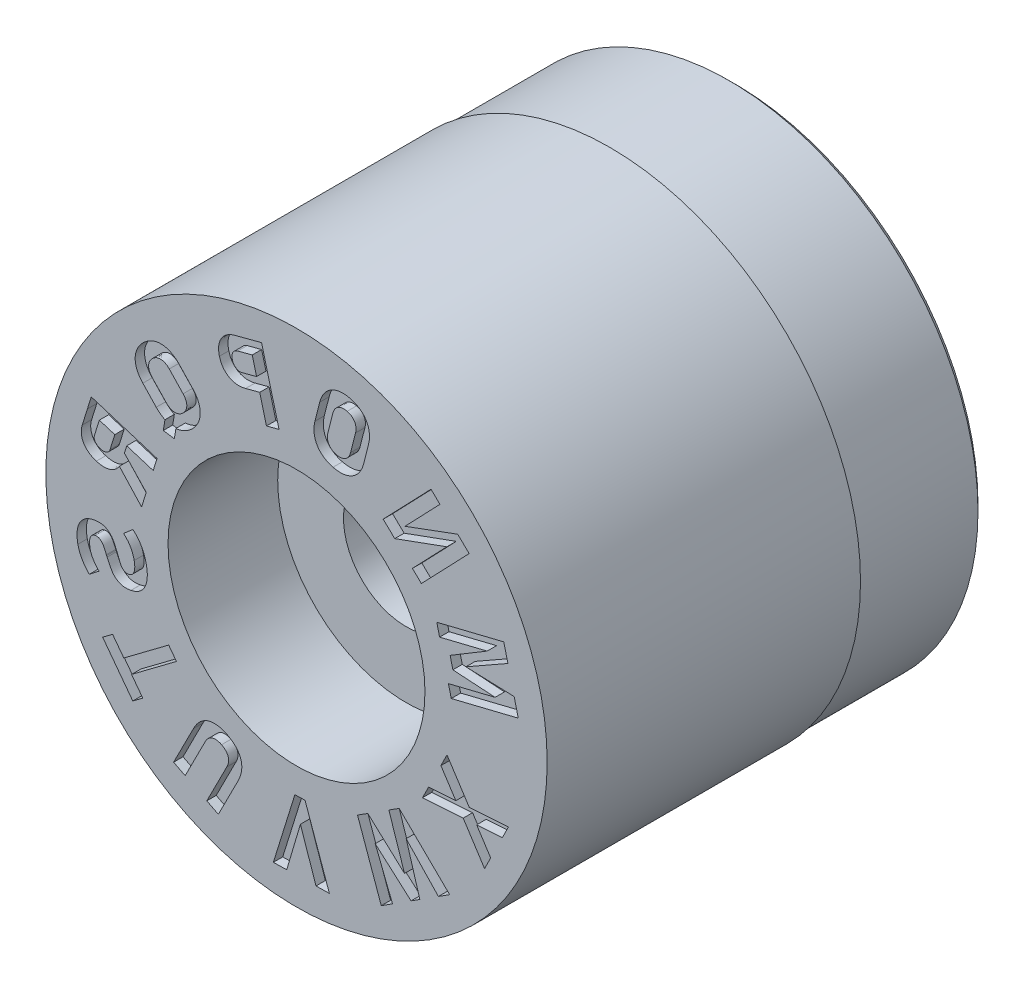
SolidWorks part; units mm, degrees
ref_plane "Front Plane" through (0, 0, 0) normal (0, 0, 1) x (1, 0, 0)
ref_plane "Top Plane" through (0, 0, 0) normal (0, 1, 0) x (1, 0, 0)
ref_plane "Right Plane" through (0, 0, 0) normal (1, 0, 0) x (0, 0, -1)
sketch "Sketch1" plane through (0, 0, 0) normal (1, 0, 0) x (0, 0, -1)
  line L2 (0, 8) -> (0, 4.1)
  line L3 (13.75, 8) -> (0, 8)
  line L4 (-3.7979, 0) -> (49996.2021, 0) construction
  line L8 (14, 2) -> (3.5, 2)
  line L9 (3.5, 4.1) -> (3.5, 2)
  line L10 (3.5, 4.1) -> (0, 4.1)
  line L12 (14, 2) -> (14, 7.75)
  line L16 (14, 7.75) -> (13.75, 8)
  dimension "D1" = 14
  dimension "D2" = 45
  dimension "D3" = 0.25
  dimension "D4" = 16
  dimension "D5" = 8.2
  dimension "D6" = 3.5
  dimension "D7" = 4
revolve "Revolve1" add sketch "Sketch1" angle 360 about L4
sketch "Sketch4" plane through (0, 0, 0) normal (1, 0, 0) x (0, 0, -1)
  line L0 (0, 0) -> (50000, 0) construction
  line L1 (14, -7.75) -> (14, 7.75) construction
  line L2 (10, 8.935) -> (14, 8.935)
  line L3 (10, 8.935) -> (10, 7.935)
  line L4 (10, 7.935) -> (14, 7.935)
  line L5 (14, 8.935) -> (14, 7.935)
  line L6 (13.75, 8) -> (0, 8) construction
  line L9 (0, 8.8) -> (0, -8.8) construction
  dimension "D1" = 1
  dimension "D2" = 0.065
  dimension "D3" = 10
revolve "Cut-Revolve1" cut sketch "Sketch4" angle 360 about L0
sketch "Sketch6" plane through (0, 0, 0) normal (0, 0, 1) x (1, 0, 0)
  line L0 (6.7464, 2.1075) -> (6.6157, 2.6387)
  line L1 (6.6157, 2.6387) -> (4.477, 2.1123)
  line L2 (4.477, 2.1123) -> (4.567, 1.746)
  line L3 (4.567, 1.746) -> (6.0852, 2.1194)
  line L5 (6.0852, 2.1194) -> (4.9026, 1.4101)
  line L6 (4.9026, 1.4101) -> (4.9902, 1.0541)
  line L7 (4.9902, 1.0541) -> (6.3387, 0.9681)
  line L9 (6.3387, 0.9681) -> (4.8489, 0.6017)
  line L10 (4.8489, 0.6017) -> (4.9388, 0.2354)
  line L11 (4.9388, 0.2354) -> (7.0775, 0.7617)
  line L12 (7.0775, 0.7617) -> (6.9468, 1.293)
  line L13 (6.9468, 1.293) -> (5.4052, 1.3451)
  line L14 (5.4052, 1.3451) -> (6.7464, 2.1075)
  line L15 (5.5114, 4.5272) -> (5.1446, 4.8792)
  line L16 (5.1446, 4.8792) -> (3.461, 4.2568)
  line L18 (3.461, 4.2568) -> (4.5786, 5.4219)
  line L19 (4.5786, 5.4219) -> (4.2921, 5.6967)
  line L20 (4.2921, 5.6967) -> (2.7665, 4.1064)
  line L21 (2.7665, 4.1064) -> (3.1351, 3.7528)
  line L22 (3.1351, 3.7528) -> (4.7985, 4.3588)
  line L24 (4.7985, 4.3588) -> (3.6988, 3.2123)
  line L25 (3.6988, 3.2123) -> (3.9858, 2.937)
  line L26 (3.9858, 2.937) -> (5.5114, 4.5272)
  line L27 (2.1433, 5.3276) -> (2.2971, 5.9308)
  line L28 (0.7419, 6.3278) -> (0.5881, 5.7246)
  line L29 (1.0015, 5.6085) -> (1.1608, 6.232)
  line L30 (1.8843, 6.0472) -> (1.725, 5.4236)
  line L31 (-1.275, 6.0266) -> (-1.7356, 5.9053)
  line L32 (-1.8744, 6.4332) -> (-1.4138, 6.5545)
  line L33 (-1.515, 6.9393) -> (-1.2975, 6.9966)
  line L34 (-1.515, 6.9393) -> (-1.9652, 6.8208)
  line L35 (-1.6242, 5.5232) -> (-1.1739, 5.6418)
  line L36 (-1.1739, 5.6418) -> (-0.9577, 4.8198)
  line L37 (-1.1153, 7.0442) -> (-1.515, 6.9393)
  line L38 (-1.4138, 6.5545) -> (-1.275, 6.0266)
  line L39 (-0.9577, 4.8198) -> (-0.558, 4.9246)
  line L40 (-0.558, 4.9246) -> (-1.1153, 7.0442)
  line L41 (-5.4183, 2.0419) -> (-4.5739, 1.7796)
  line L42 (-4.1977, 3.373) -> (-4.2512, 3.048)
  line L43 (-4.2512, 3.048) -> (-3.8988, 2.9963)
  line L44 (-3.8988, 2.9963) -> (-3.8481, 3.306)
  line L45 (-3.3167, 4.6804) -> (-3.7439, 5.1306)
  line L46 (-4.9047, 4.0291) -> (-4.4775, 3.5789)
  line L47 (-4.1594, 3.8661) -> (-4.6011, 4.3315)
  line L48 (-4.0611, 4.8437) -> (-3.6194, 4.3784)
  line L49 (-5.7995, 2.1603) -> (-5.9526, 1.6677)
  line L50 (-6.4464, 1.821) -> (-6.2933, 2.3136)
  line L51 (-6.2933, 2.3136) -> (-5.7995, 2.1603)
  line L52 (-6.6739, 2.4318) -> (-6.8367, 1.908)
  line L53 (-5.4929, 1.8018) -> (-5.4183, 2.0419)
  line L54 (-5.5113, -3.87) -> (-5.8687, -3.3935)
  line L55 (-6.5513, 2.8275) -> (-6.6741, 2.4319)
  line L56 (-6.6741, 2.4319) -> (-6.6739, 2.4318)
  line L57 (-4.5739, 1.7796) -> (-4.4511, 2.1752)
  line L58 (-4.4511, 2.1752) -> (-6.5513, 2.8275)
  line L60 (-5.6536, 1.3577) -> (-4.944, 0.587)
  line L61 (-4.944, 0.587) -> (-4.7951, 1.0664)
  line L62 (-4.7951, 1.0664) -> (-5.4929, 1.8018)
  line L63 (-5.221, -0.1738) -> (-5.5184, -0.4295)
  line L64 (-5.3549, -1.4803) -> (-5.3564, -1.4804)
  line L65 (-5.6922, -1.1371) -> (-5.7034, -1.1054)
  line L66 (-6.4725, -0.5301) -> (-6.4743, -0.5303)
  line L67 (-6.6134, -2.1068) -> (-6.303, -1.8662)
  line L68 (-6.432, -0.9418) -> (-6.4306, -0.9417)
  line L69 (-5.2849, -1.8861) -> (-5.2817, -1.8857)
  line L71 (-5.2639, -4.1997) -> (-3.8318, -3.1256)
  line L72 (-3.8318, -3.1256) -> (-4.079, -2.7957)
  line L73 (-4.079, -2.7957) -> (-5.5113, -3.87)
  line L74 (-6.1871, -3.6319) -> (-5.2249, -4.9146)
  line L75 (-5.2249, -4.9146) -> (-4.9065, -4.6762)
  line L76 (-4.9065, -4.6762) -> (-5.2639, -4.1997)
  line L77 (-5.8687, -3.3935) -> (-6.1871, -3.6319)
  line L78 (-3.2882, -4.7082) -> (-3.9221, -5.9559)
  line L79 (-3.9221, -5.9559) -> (-3.5536, -6.143)
  line L80 (-3.5536, -6.143) -> (-2.9151, -4.8858)
  line L81 (-2.224, -5.2369) -> (-2.8626, -6.4942)
  line L82 (-2.8626, -6.4942) -> (-2.4941, -6.6813)
  line L83 (-2.4941, -6.6813) -> (-1.8602, -5.4336)
  line L84 (-0.7394, -7.1323) -> (-0.3126, -7.1238)
  line L85 (-0.3126, -7.1238) -> (0.125, -5.6466)
  line L86 (0.125, -5.6466) -> (0.6222, -7.1048)
  line L87 (0.6222, -7.1048) -> (1.0491, -7.0963)
  line L88 (1.0491, -7.0963) -> (0.2726, -4.911)
  line L89 (0.2726, -4.911) -> (-0.0515, -4.9175)
  line L90 (-0.0515, -4.9175) -> (-0.7394, -7.1323)
  line L91 (3.6563, -5.9987) -> (3.9362, -5.8196)
  line L92 (3.9362, -5.8196) -> (3.5003, -4.3574)
  line L93 (3.5003, -4.3574) -> (4.5287, -5.4408)
  line L94 (4.5287, -5.4408) -> (4.8879, -5.2111)
  line L95 (4.8879, -5.2111) -> (3.2769, -3.6323)
  line L96 (3.2769, -3.6323) -> (2.948, -3.8425)
  line L97 (2.948, -3.8425) -> (3.4472, -5.346)
  line L98 (3.4472, -5.346) -> (2.2759, -4.2724)
  line L99 (2.2759, -4.2724) -> (1.9474, -4.4827)
  line L100 (1.9474, -4.4827) -> (2.705, -6.6074)
  line L101 (2.705, -6.6074) -> (3.0642, -6.3777)
  line L102 (3.0642, -6.3777) -> (2.5119, -4.9895)
  line L103 (2.5119, -4.9895) -> (3.6563, -5.9987)
  line L105 (5.3198, -2.8798) -> (6.0024, -3.9343)
  line L106 (6.0024, -3.9343) -> (6.1975, -3.5416)
  line L107 (6.1975, -3.5416) -> (5.7497, -2.8505)
  line L109 (5.5137, -2.4868) -> (4.8039, -1.39)
  line L110 (4.8039, -1.39) -> (4.6088, -1.7828)
  line L111 (4.6088, -1.7828) -> (5.0843, -2.5162)
  line L112 (5.7497, -2.8505) -> (6.5693, -2.7943)
  line L113 (6.5693, -2.7943) -> (6.7644, -2.4016)
  line L114 (6.7644, -2.4016) -> (5.5137, -2.4868)
  line L115 (5.0843, -2.5162) -> (4.2143, -2.5759)
  line L116 (4.2143, -2.5759) -> (4.0192, -2.9686)
  line L117 (4.0192, -2.9686) -> (5.3198, -2.8798)
  spline S0 degree 3 poles (1.1653, 4.7409) (1.203, 4.732) (1.2592, 4.7195) (1.3344, 4.7119) (1.389, 4.7091) (1.4427, 4.71) (1.4955, 4.7141) (1.5474, 4.7221) (1.5982, 4.7332) (1.6476, 4.7481) (1.6952, 4.7659) (1.7411, 4.787) (1.785, 4.8112) (1.827, 4.8389) (1.8672, 4.8693) (1.9056, 4.903) (1.9421, 4.9398) (1.9764, 4.9793) (2.0081, 5.0215) (2.0372, 5.0663) (2.0634, 5.1138) (2.0873, 5.1636) (2.117, 5.234) (2.1332, 5.2898) (2.1433, 5.3276) knots 0 0 0 0 0.090554 0.13409 0.176391 0.218073 0.259307 0.299989 0.340594 0.380562 0.420342 0.459142 0.498428 0.53716 0.576489 0.616141 0.656309 0.697182 0.738191 0.779538 0.821765 0.8647 0.908479 1 1 1 1
  spline S1 degree 3 poles (2.2971, 5.9308) (2.307, 5.9687) (2.3177, 6.0257) (2.3273, 6.1017) (2.3296, 6.157) (2.3292, 6.2112) (2.3251, 6.2643) (2.318, 6.3167) (2.3067, 6.3678) (2.2927, 6.4177) (2.2747, 6.4655) (2.2547, 6.5119) (2.2302, 6.5556) (2.204, 6.5983) (2.1734, 6.6383) (2.1403, 6.677) (2.1038, 6.7133) (2.0646, 6.7474) (2.0231, 6.7794) (1.9788, 6.8086) (1.932, 6.8351) (1.8826, 6.8587) (1.8128, 6.8879) (1.7578, 6.9047) (1.7203, 6.9143) knots 0 0 0 0 0.091341 0.135407 0.178493 0.220488 0.262023 0.302787 0.343665 0.384141 0.423666 0.462901 0.501902 0.540681 0.5797 0.619483 0.659323 0.699862 0.740591 0.781629 0.823523 0.866115 0.909552 1 1 1 1
  spline S2 degree 3 poles (1.7203, 6.9143) (1.683, 6.9245) (1.6266, 6.935) (1.5516, 6.9436) (1.4968, 6.9467) (1.4431, 6.9452) (1.3904, 6.9409) (1.3385, 6.933) (1.2877, 6.9217) (1.2382, 6.9074) (1.1906, 6.8894) (1.1448, 6.8684) (1.1007, 6.8445) (1.0588, 6.8167) (1.0186, 6.7863) (0.98, 6.7526) (0.9437, 6.7156) (0.9092, 6.676) (0.8776, 6.6337) (0.8479, 6.5893) (0.8219, 6.5416) (0.7979, 6.4919) (0.7682, 6.4215) (0.752, 6.3657) (0.7419, 6.3278) knots 0 0 0 0 0.090234 0.13364 0.176254 0.218101 0.259038 0.299716 0.340319 0.380534 0.419819 0.459105 0.498097 0.536827 0.576153 0.615801 0.6563 0.69717 0.738176 0.779554 0.821778 0.86471 0.908486 1 1 1 1
  spline S3 degree 3 poles (0.5881, 5.7246) (0.5782, 5.6868) (0.5675, 5.6297) (0.5579, 5.5538) (0.5556, 5.4985) (0.556, 5.4443) (0.56, 5.391) (0.5678, 5.3387) (0.5787, 5.2875) (0.5934, 5.2379) (0.6105, 5.1898) (0.6313, 5.1438) (0.6555, 5.0998) (0.6824, 5.0573) (0.7122, 5.0167) (0.7459, 4.9785) (0.7819, 4.9417) (0.8214, 4.9078) (0.8628, 4.8756) (0.9074, 4.847) (0.9541, 4.8205) (1.0031, 4.7963) (1.0729, 4.7675) (1.1277, 4.7503) (1.1653, 4.7409) knots 0 0 0 0 0.09134 0.135404 0.17849 0.220483 0.262018 0.302986 0.343863 0.384085 0.423845 0.462863 0.501863 0.540943 0.580112 0.619442 0.659719 0.700257 0.740985 0.781989 0.823882 0.866114 0.90955 1 1 1 1
  spline S4 degree 3 poles (1.2676, 5.1423) (1.2335, 5.1513) (1.1842, 5.1691) (1.126, 5.2049) (1.0885, 5.2363) (1.0563, 5.2718) (1.0298, 5.3114) (1.009, 5.3542) (0.9945, 5.4008) (0.9867, 5.45) (0.9836, 5.5202) (0.9928, 5.5733) (1.0015, 5.6085) knots 0 0 0 0 0.174985 0.257482 0.337889 0.41693 0.494551 0.572982 0.652657 0.735237 0.819921 1 1 1 1
  spline S5 degree 3 poles (1.1608, 6.232) (1.1706, 6.2669) (1.1872, 6.3182) (1.2239, 6.3778) (1.2544, 6.4173) (1.2893, 6.4512) (1.328, 6.4792) (1.3701, 6.501) (1.4155, 6.5169) (1.4636, 6.5261) (1.5318, 6.5303) (1.5835, 6.5216) (1.6176, 6.5131) knots 0 0 0 0 0.18045 0.264422 0.346617 0.427066 0.505014 0.58279 0.662026 0.742762 0.824933 1 1 1 1
  spline S6 degree 3 poles (1.6176, 6.5131) (1.6521, 6.5051) (1.7009, 6.4862) (1.7592, 6.4506) (1.7968, 6.4192) (1.8287, 6.3836) (1.8559, 6.3445) (1.876, 6.3011) (1.891, 6.2548) (1.8993, 6.2056) (1.9012, 6.1355) (1.8936, 6.0824) (1.8843, 6.0472) knots 0 0 0 0 0.175069 0.257563 0.337967 0.417005 0.494272 0.573144 0.653342 0.735329 0.819642 1 1 1 1
  spline S7 degree 3 poles (1.725, 5.4236) (1.7158, 5.3885) (1.6975, 5.3379) (1.6619, 5.2774) (1.6312, 5.238) (1.5964, 5.2039) (1.5572, 5.1765) (1.5151, 5.1545) (1.4698, 5.1385) (1.4217, 5.1299) (1.3536, 5.1255) (1.3018, 5.1344) (1.2676, 5.1423) knots 0 0 0 0 0.180266 0.264874 0.347008 0.427399 0.505625 0.583344 0.662522 0.742738 0.824849 1 1 1 1
  spline S8 degree 3 poles (-1.7356, 5.9053) (-1.7582, 5.8993) (-1.7925, 5.8944) (-1.8379, 5.8972) (-1.8701, 5.9042) (-1.9008, 5.9159) (-1.9299, 5.9308) (-1.9562, 5.9512) (-1.9805, 5.9749) (-2.0024, 6.0023) (-2.0267, 6.0449) (-2.0401, 6.0799) (-2.0463, 6.1045) knots 0 0 0 0 0.169219 0.248097 0.327749 0.406805 0.485095 0.564039 0.646178 0.730445 0.816959 1 1 1 1
  spline S9 degree 3 poles (-2.0463, 6.1045) (-2.0535, 6.1292) (-2.0588, 6.1668) (-2.0594, 6.2164) (-2.0539, 6.2512) (-2.0457, 6.2843) (-2.032, 6.3145) (-2.0151, 6.3427) (-1.9936, 6.3676) (-1.9687, 6.3894) (-1.9304, 6.4148) (-1.8972, 6.4269) (-1.8744, 6.4332) knots 0 0 0 0 0.184584 0.271052 0.355147 0.436297 0.515234 0.59253 0.671241 0.750119 0.829666 1 1 1 1
  spline S10 degree 3 poles (-1.9652, 6.8208) (-2.0277, 6.8039) (-2.1179, 6.7714) (-2.2245, 6.7061) (-2.2937, 6.6499) (-2.3537, 6.5867) (-2.4031, 6.5166) (-2.4414, 6.4402) (-2.4689, 6.3583) (-2.4851, 6.272) (-2.4916, 6.1495) (-2.4757, 6.0568) (-2.4603, 5.9956) knots 0 0 0 0 0.179477 0.263146 0.345424 0.425559 0.503885 0.582072 0.661518 0.742295 0.824748 1 1 1 1
  spline S11 degree 3 poles (-2.4603, 5.9956) (-2.4444, 5.9345) (-2.4115, 5.8466) (-2.3459, 5.7433) (-2.2895, 5.6762) (-2.2255, 5.6187) (-2.1545, 5.5719) (-2.0775, 5.5351) (-1.9942, 5.5099) (-1.9064, 5.4949) (-1.7814, 5.4918) (-1.6869, 5.5068) (-1.6242, 5.5232) knots 0 0 0 0 0.175519 0.257739 0.338754 0.417967 0.495682 0.57369 0.654076 0.736334 0.820263 1 1 1 1
  spline S12 degree 3 poles (-3.3408, 3.544) (-3.3126, 3.5702) (-3.2733, 3.6119) (-3.2267, 3.671) (-3.1955, 3.7159) (-3.1672, 3.7614) (-3.1434, 3.8086) (-3.1223, 3.8564) (-3.1049, 3.9053) (-3.0912, 3.9547) (-3.0809, 4.0044) (-3.074, 4.0542) (-3.0718, 4.1042) (-3.0719, 4.1542) (-3.0768, 4.2042) (-3.0844, 4.2544) (-3.0961, 4.3046) (-3.1116, 4.3543) (-3.13, 4.4037) (-3.1529, 4.4518) (-3.1786, 4.4994) (-3.2078, 4.5461) (-3.252, 4.608) (-3.2898, 4.652) (-3.3167, 4.6804) knots 0 0 0 0 0.090196 0.133908 0.176363 0.218192 0.25925 0.300021 0.340564 0.380741 0.420056 0.459394 0.498256 0.537195 0.576458 0.615803 0.656247 0.696897 0.737813 0.779475 0.821747 0.864483 0.908334 1 1 1 1
  spline S13 degree 3 poles (-3.7439, 5.1306) (-3.7702, 5.1595) (-3.8129, 5.1986) (-3.8724, 5.2462) (-3.9172, 5.2784) (-3.9636, 5.3062) (-4.0105, 5.3315) (-4.0587, 5.3527) (-4.1077, 5.3707) (-4.1572, 5.3849) (-4.2068, 5.3958) (-4.2568, 5.4021) (-4.3067, 5.406) (-4.3567, 5.4051) (-4.4067, 5.4017) (-4.4568, 5.3938) (-4.5069, 5.3826) (-4.5565, 5.3675) (-4.6056, 5.3496) (-4.6536, 5.3277) (-4.7008, 5.3022) (-4.7471, 5.2732) (-4.8085, 5.2295) (-4.8519, 5.1922) (-4.8801, 5.1659) knots 0 0 0 0 0.091445 0.135353 0.178471 0.220602 0.261946 0.303164 0.343802 0.384052 0.423761 0.462745 0.501958 0.540892 0.579709 0.619391 0.659397 0.699922 0.740693 0.781714 0.823499 0.866229 0.909583 1 1 1 1
  spline S14 degree 3 poles (-4.8801, 5.1659) (-4.9079, 5.1393) (-4.9474, 5.098) (-4.9945, 5.0392) (-5.0253, 4.9942) (-5.0532, 4.9486) (-5.0776, 4.9019) (-5.0986, 4.8539) (-5.116, 4.805) (-5.1298, 4.7555) (-5.1401, 4.7058) (-5.1467, 4.6559) (-5.15, 4.6059) (-5.1486, 4.5558) (-5.1449, 4.5057) (-5.1364, 4.4555) (-5.1248, 4.4052) (-5.1094, 4.3553) (-5.0909, 4.3059) (-5.0686, 4.2575) (-5.0428, 4.2101) (-5.0137, 4.1634) (-4.9694, 4.1014) (-4.9316, 4.0575) (-4.9047, 4.0291) knots 0 0 0 0 0.09016 0.133576 0.17632 0.217664 0.258857 0.29962 0.340153 0.380321 0.419973 0.458953 0.498157 0.537111 0.576317 0.615725 0.656161 0.69713 0.738037 0.779526 0.821788 0.864514 0.908355 1 1 1 1
  spline S15 degree 3 poles (-4.4775, 3.5789) (-4.4512, 3.55) (-4.4085, 3.5109) (-4.349, 3.4633) (-4.3042, 3.4311) (-4.2579, 3.4032) (-4.2222, 3.3845) (-4.202, 3.3749) (-4.1977, 3.373) knots 0 0 0 0 0.091418 0.135313 0.178419 0.220537 0.261722 0.272771 0.272771 0.272771 0.272771
  spline S16 degree 3 poles (-3.625, 3.8435) (-3.6508, 3.8197) (-3.6915, 3.7866) (-3.7532, 3.7574) (-3.7995, 3.742) (-3.8466, 3.7338) (-3.894, 3.732) (-3.9412, 3.7378) (-3.988, 3.7503) (-4.0339, 3.7693) (-4.094, 3.8048) (-4.1348, 3.8395) (-4.1594, 3.8661) knots 0 0 0 0 0.175489 0.257694 0.338213 0.41759 0.495224 0.573486 0.65327 0.735364 0.819848 1 1 1 1
  spline S17 degree 3 poles (-4.6011, 4.3315) (-4.6262, 4.3576) (-4.659, 4.3999) (-4.6911, 4.462) (-4.708, 4.5087) (-4.7184, 4.5561) (-4.7212, 4.6036) (-4.7175, 4.6509) (-4.7063, 4.6976) (-4.6886, 4.743) (-4.6558, 4.8027) (-4.6212, 4.8419) (-4.5959, 4.8664) knots 0 0 0 0 0.18014 0.264433 0.346734 0.426813 0.504651 0.582752 0.662088 0.742734 0.824537 1 1 1 1
  spline S18 degree 3 poles (-4.5959, 4.8664) (-4.5705, 4.8906) (-4.529, 4.9224) (-4.4679, 4.9526) (-4.4216, 4.9677) (-4.3746, 4.9764) (-4.3274, 4.9772) (-4.28, 4.9722) (-4.2331, 4.9597) (-4.1871, 4.9406) (-4.1268, 4.905) (-4.086, 4.8702) (-4.0611, 4.8437) knots 0 0 0 0 0.174979 0.257512 0.338 0.416624 0.494168 0.572354 0.652836 0.734899 0.819352 1 1 1 1
  spline S19 degree 3 poles (-3.6194, 4.3784) (-3.5947, 4.3521) (-3.5618, 4.3099) (-3.5299, 4.2479) (-3.5127, 4.2011) (-3.5032, 4.1535) (-3.5001, 4.1059) (-3.504, 4.0588) (-3.5145, 4.0121) (-3.5324, 3.9667) (-3.5656, 3.9072) (-3.5996, 3.8677) (-3.625, 3.8435) knots 0 0 0 0 0.179787 0.264153 0.346528 0.427207 0.505114 0.583283 0.661827 0.742544 0.825414 1 1 1 1
  spline S20 degree 3 poles (-5.9526, 1.6677) (-5.9579, 1.6482) (-5.9709, 1.6212) (-5.9945, 1.5897) (-6.0154, 1.5698) (-6.0391, 1.5531) (-6.0652, 1.5396) (-6.0941, 1.5308) (-6.1248, 1.5251) (-6.1575, 1.523) (-6.2041, 1.5257) (-6.2393, 1.5325) (-6.2626, 1.5393) knots 0 0 0 0 0.160082 0.236396 0.313016 0.389134 0.466418 0.54623 0.628769 0.715269 0.806175 1 1 1 1
  spline S21 degree 3 poles (-6.2626, 1.5393) (-6.2857, 1.5468) (-6.3191, 1.5598) (-6.3589, 1.5841) (-6.3845, 1.6044) (-6.4066, 1.6267) (-6.4253, 1.6505) (-6.4397, 1.6762) (-6.45, 1.7035) (-6.4557, 1.7318) (-6.4586, 1.7716) (-6.452, 1.8015) (-6.4464, 1.821) knots 0 0 0 0 0.193075 0.282175 0.368978 0.452273 0.530685 0.608675 0.685355 0.760869 0.83776 1 1 1 1
  spline S22 degree 3 poles (-6.8367, 1.908) (-6.8541, 1.8533) (-6.8699, 1.7695) (-6.8684, 1.6582) (-6.8554, 1.5791) (-6.8313, 1.5036) (-6.7973, 1.4322) (-6.7522, 1.3662) (-6.6973, 1.3055) (-6.6327, 1.2511) (-6.5332, 1.1851) (-6.4476, 1.1515) (-6.3888, 1.1325) knots 0 0 0 0 0.170946 0.251283 0.330228 0.408509 0.486395 0.564685 0.645585 0.729175 0.815468 1 1 1 1
  spline S23 degree 3 poles (-6.3888, 1.1325) (-6.3298, 1.114) (-6.2404, 1.0948) (-6.1214, 1.0916) (-6.0374, 1.1006) (-5.9578, 1.1197) (-5.883, 1.1484) (-5.8146, 1.1884) (-5.7519, 1.2374) (-5.6973, 1.2939) (-5.667, 1.3363) (-5.6536, 1.3577) knots 0 0 0 0 0.18419 0.270383 0.353733 0.435075 0.513612 0.591479 0.670335 0.74975 0.824975 0.824975 0.824975 0.824975
  spline S24 degree 3 poles (-4.7913, -0.9324) (-4.8015, -0.8813) (-4.8201, -0.8055) (-4.8537, -0.7075) (-4.8823, -0.636) (-4.9144, -0.5671) (-4.949, -0.5004) (-4.9875, -0.4369) (-5.0289, -0.3765) (-5.0732, -0.3198) (-5.135, -0.25) (-5.1853, -0.2025) (-5.221, -0.1738) knots 0 0 0 0 0.175952 0.262878 0.349633 0.435446 0.51951 0.60318 0.685678 0.766805 0.845757 1 1 1 1
  spline S25 degree 3 poles (-5.5184, -0.4295) (-5.4759, -0.4646) (-5.416, -0.5232) (-5.3485, -0.6129) (-5.3018, -0.6854) (-5.2613, -0.7625) (-5.2157, -0.8693) (-5.1917, -0.9532) (-5.1804, -1.0101) knots 0 0 0 0 0.24178 0.365031 0.491421 0.619 0.74604 1 1 1 1
  spline S26 degree 3 poles (-5.1804, -1.0101) (-5.1744, -1.0415) (-5.167, -1.0876) (-5.1619, -1.1479) (-5.1611, -1.1894) (-5.1633, -1.2286) (-5.1681, -1.2655) (-5.1754, -1.3) (-5.1856, -1.332) (-5.1979, -1.3614) (-5.2128, -1.388) (-5.2309, -1.4108) (-5.2505, -1.4315) (-5.273, -1.4487) (-5.3072, -1.4672) (-5.3354, -1.4763) (-5.3549, -1.4803) knots 0 0 0 0 0.170981 0.248982 0.322798 0.392773 0.458216 0.521321 0.580802 0.637812 0.691298 0.742781 0.793195 0.842761 0.893358 1 1 1 1
  spline S27 degree 3 poles (-5.3564, -1.4804) (-5.3824, -1.4852) (-5.422, -1.489) (-5.4712, -1.4757) (-5.5035, -1.4594) (-5.5323, -1.4374) (-5.5587, -1.4112) (-5.5827, -1.3807) (-5.6038, -1.3453) (-5.6236, -1.3048) (-5.652, -1.2405) (-5.6726, -1.189) (-5.6858, -1.1525) knots 0 0 0 0 0.155444 0.225674 0.294852 0.364783 0.436631 0.510834 0.590193 0.676666 0.773414 1 1 1 1
  spline S28 degree 3 poles (-5.6858, -1.1525) (-5.6872, -1.15) (-5.69, -1.1451) (-5.6906, -1.1395) (-5.6922, -1.1371) knots 0 0 0 0 0.513306 1 1 1 1
  spline S29 degree 3 poles (-5.7034, -1.1054) (-5.7265, -1.0407) (-5.7641, -0.9494) (-5.8186, -0.836) (-5.8588, -0.7638) (-5.9028, -0.699) (-5.9566, -0.6437) (-6.0184, -0.5951) (-6.0765, -0.5617) (-6.1273, -0.5394) (-6.1686, -0.5266) (-6.2126, -0.5173) (-6.2594, -0.5127) (-6.3089, -0.5112) (-6.3806, -0.5145) (-6.4354, -0.5229) (-6.4725, -0.5301) knots 0 0 0 0 0.19051 0.274064 0.349312 0.419884 0.490701 0.562604 0.637467 0.676202 0.716262 0.757466 0.800915 0.846419 0.894988 1 1 1 1
  spline S30 degree 3 poles (-6.4743, -0.5303) (-6.5081, -0.5371) (-6.5572, -0.5501) (-6.6199, -0.5724) (-6.6635, -0.5921) (-6.7048, -0.614) (-6.7439, -0.6382) (-6.78, -0.6656) (-6.8138, -0.695) (-6.8451, -0.727) (-6.8733, -0.7614) (-6.8988, -0.798) (-6.9217, -0.8367) (-6.942, -0.8774) (-6.9595, -0.9206) (-6.974, -0.9658) (-6.9861, -1.0132) (-6.9952, -1.0625) (-7.0011, -1.1137) (-7.0045, -1.1667) (-7.005, -1.2217) (-7.0022, -1.2784) (-6.995, -1.358) (-6.9858, -1.4183) (-6.9774, -1.4588) knots 0 0 0 0 0.086172 0.127019 0.166716 0.205827 0.244168 0.281666 0.319193 0.356255 0.393601 0.430466 0.467901 0.50611 0.544493 0.584325 0.624979 0.666928 0.709832 0.754031 0.79999 0.847356 0.896374 1 1 1 1
  spline S31 degree 3 poles (-6.9774, -1.4588) (-6.9694, -1.4978) (-6.9547, -1.5564) (-6.9272, -1.6326) (-6.8961, -1.7099) (-6.8484, -1.8044) (-6.7583, -1.9492) (-6.6744, -2.047) (-6.6134, -2.1068) knots 0 0 0 0 0.158593 0.239577 0.32224 0.490362 0.65979 1 1 1 1
  spline S32 degree 3 poles (-6.303, -1.8662) (-6.3396, -1.8311) (-6.39, -1.7749) (-6.4496, -1.6947) (-6.4891, -1.6331) (-6.5235, -1.5704) (-6.5604, -1.4878) (-6.5795, -1.4239) (-6.5883, -1.3811) knots 0 0 0 0 0.266218 0.39575 0.525008 0.650598 0.770806 1 1 1 1
  spline S33 degree 3 poles (-6.5883, -1.3811) (-6.5948, -1.3518) (-6.6005, -1.3083) (-6.6059, -1.2518) (-6.6062, -1.2129) (-6.6045, -1.1762) (-6.6007, -1.1416) (-6.5938, -1.1093) (-6.585, -1.0794) (-6.5738, -1.0519) (-6.5597, -1.0276) (-6.5444, -1.0057) (-6.5262, -0.987) (-6.5057, -0.9713) (-6.4755, -0.9531) (-6.4495, -0.9458) (-6.432, -0.9418) knots 0 0 0 0 0.172939 0.252434 0.326605 0.397072 0.464128 0.526685 0.586647 0.643865 0.697243 0.747886 0.797621 0.846695 0.896244 1 1 1 1
  spline S34 degree 3 poles (-6.4306, -0.9417) (-6.4023, -0.9355) (-6.3597, -0.9336) (-6.3059, -0.9462) (-6.2715, -0.9647) (-6.2407, -0.9883) (-6.2127, -1.0159) (-6.1876, -1.047) (-6.165, -1.083) (-6.1433, -1.1248) (-6.1095, -1.1946) (-6.0853, -1.2517) (-6.0684, -1.2925) knots 0 0 0 0 0.156435 0.226827 0.295562 0.365756 0.435926 0.507449 0.58124 0.664778 0.761812 1 1 1 1
  spline S35 degree 3 poles (-6.0684, -1.2925) (-6.0667, -1.2961) (-6.0642, -1.304) (-6.0617, -1.3118) (-6.0598, -1.3156) knots 0 0 0 0 0.490921 1 1 1 1
  spline S36 degree 3 poles (-6.0598, -1.3156) (-6.0578, -1.3211) (-6.0526, -1.3317) (-6.0475, -1.3424) (-6.0454, -1.348) knots 0 0 0 0 0.493683 1 1 1 1
  spline S37 degree 3 poles (-6.0454, -1.348) (-6.0201, -1.4085) (-5.9819, -1.4953) (-5.9236, -1.6014) (-5.8817, -1.6703) (-5.8351, -1.731) (-5.7803, -1.7829) (-5.7187, -1.8279) (-5.6616, -1.8586) (-5.6122, -1.879) (-5.5721, -1.8902) (-5.5298, -1.8983) (-5.4854, -1.9031) (-5.4383, -1.9041) (-5.371, -1.9003) (-5.3196, -1.8932) (-5.2849, -1.8861) knots 0 0 0 0 0.189733 0.273567 0.349741 0.422345 0.494076 0.56695 0.642148 0.680928 0.72119 0.762031 0.805317 0.85017 0.897837 1 1 1 1
  spline S38 degree 3 poles (-5.2817, -1.8857) (-5.2485, -1.8792) (-5.2001, -1.8664) (-5.1384, -1.8434) (-5.095, -1.8244) (-5.0546, -1.8014) (-5.0164, -1.7765) (-4.9805, -1.7491) (-4.9474, -1.7187) (-4.9167, -1.6862) (-4.8886, -1.6511) (-4.8637, -1.6135) (-4.8408, -1.574) (-4.8217, -1.5317) (-4.8041, -1.4876) (-4.7901, -1.4409) (-4.7788, -1.392) (-4.7704, -1.3409) (-4.7647, -1.288) (-4.7615, -1.2333) (-4.7617, -1.1768) (-4.7645, -1.1182) (-4.7732, -1.0363) (-4.7829, -0.9742) (-4.7913, -0.9324) knots 0 0 0 0 0.083485 0.123386 0.162537 0.200456 0.238037 0.275114 0.312019 0.348869 0.385555 0.422828 0.460196 0.498344 0.53725 0.577385 0.618673 0.661292 0.705078 0.750159 0.796508 0.844738 0.894848 1 1 1 1
  spline S39 degree 3 poles (-2.2061, -4.3423) (-2.2426, -4.3242) (-2.2972, -4.2989) (-2.3716, -4.2725) (-2.4258, -4.2571) (-2.4791, -4.2447) (-2.5319, -4.2365) (-2.584, -4.2324) (-2.6352, -4.2314) (-2.6855, -4.2342) (-2.7348, -4.2406) (-2.7829, -4.2509) (-2.8299, -4.2645) (-2.8757, -4.2817) (-2.9201, -4.3035) (-2.9638, -4.3278) (-3.0059, -4.3567) (-3.0467, -4.3887) (-3.086, -4.4242) (-3.1238, -4.4629) (-3.1601, -4.5051) (-3.1946, -4.551) (-3.2393, -4.6178) (-3.2695, -4.6711) (-3.2882, -4.7082) knots 0 0 0 0 0.094114 0.138798 0.182063 0.224121 0.265101 0.305212 0.344608 0.383264 0.421395 0.459224 0.496654 0.534232 0.572122 0.610675 0.64968 0.68972 0.730293 0.77192 0.814428 0.858737 0.904243 1 1 1 1
  spline S40 degree 3 poles (-2.9151, -4.8858) (-2.9014, -4.8595) (-2.8796, -4.8215) (-2.8443, -4.777) (-2.8176, -4.7476) (-2.7888, -4.7226) (-2.7582, -4.7016) (-2.7265, -4.6834) (-2.6926, -4.6702) (-2.6579, -4.6603) (-2.6221, -4.6546) (-2.5855, -4.6534) (-2.5481, -4.6555) (-2.5098, -4.6622) (-2.4564, -4.6775) (-2.4167, -4.6934) (-2.391, -4.7069) knots 0 0 0 0 0.141479 0.207312 0.27044 0.330466 0.388879 0.447 0.504344 0.561355 0.619003 0.676479 0.735655 0.797097 0.861493 1 1 1 1
  spline S41 degree 3 poles (-2.391, -4.7069) (-2.3648, -4.7201) (-2.3281, -4.7424) (-2.2841, -4.7769) (-2.2561, -4.804) (-2.2313, -4.8327) (-2.2113, -4.8637) (-2.194, -4.8959) (-2.1817, -4.9301) (-2.1723, -4.9652) (-2.1679, -5.0016) (-2.1667, -5.0388) (-2.1703, -5.0769) (-2.1778, -5.1157) (-2.1927, -5.1704) (-2.2104, -5.2104) (-2.224, -5.2369) knots 0 0 0 0 0.139145 0.203188 0.265137 0.324189 0.382448 0.439852 0.497362 0.554684 0.612168 0.670826 0.731173 0.793426 0.858592 1 1 1 1
  spline S42 degree 3 poles (-1.8602, -5.4336) (-1.8419, -5.3964) (-1.816, -5.3409) (-1.7891, -5.2652) (-1.7728, -5.2101) (-1.7601, -5.1558) (-1.7511, -5.1024) (-1.7458, -5.0497) (-1.744, -4.9977) (-1.7466, -4.9467) (-1.7517, -4.8968) (-1.7611, -4.8481) (-1.774, -4.8007) (-1.7911, -4.7546) (-1.8111, -4.7095) (-1.8354, -4.666) (-1.863, -4.6236) (-1.8941, -4.5827) (-1.9285, -4.5433) (-1.9661, -4.5054) (-2.0076, -4.4696) (-2.0522, -4.4351) (-2.1175, -4.3906) (-2.1695, -4.3604) (-2.2061, -4.3423) knots 0 0 0 0 0.095525 0.140912 0.185148 0.227895 0.26931 0.31005 0.349812 0.389082 0.427668 0.465422 0.503364 0.540653 0.578694 0.616894 0.655534 0.695158 0.735268 0.776049 0.818086 0.86148 0.906043 1 1 1 1
  spline S43 degree 3 poles (-3.8481, 3.306) (-3.8368, 3.3067) (-3.8087, 3.3089) (-3.7639, 3.3162) (-3.7137, 3.3272) (-3.664, 3.3423) (-3.6149, 3.3602) (-3.5669, 3.3822) (-3.5197, 3.4076) (-3.4734, 3.4366) (-3.4121, 3.4803) (-3.3687, 3.5175) (-3.3408, 3.544) knots 0.5535 0.5535 0.5535 0.5535 0.580086 0.619414 0.659745 0.700259 0.741018 0.782027 0.823799 0.866517 0.909857 1 1 1 1
extrude "Cut-Extrude1" cut sketch "Sketch6" against normal blind 0.3 contours S10 S11 L35 L36 L39 L40 L37 L34 S8 S9 L32 L38 L31 | L44 S43 S12 L45 S13 S14 L46 S15 L42 L43 L48 S19 S16 L47 S17 S18 | S22 S23 L60 L61 L62 L53 L41 L57 L58 L55 L56 L52 S20 S21 L50 L51 L49 | L28 S3 S0 L27 S1 S2 L30 S7 S4 L29 S5 S6 | L25 L26 L15 L16 L18 L19 L20 L21 L22 L24 | L13 L14 L0 L1 L2 L3 L5 L6 L7 L9 L10 L11 L12 | L116 L117 L105 L106 L107 L112 L113 L114 L109 L110 L111 L115 | L102 L103 L91 L92 L93 L94 L95 L96 L97 L98 L99 L100 L101 | L89 L90 L84 L85 L86 L87 L88 | L83 S42 S39 L78 L79 L80 S40 S41 L81 L82 | L54 L77 L74 L75 L76 L71 L72 L73 | L69 S38 S24 L63 S25 S26 L64 S27 S28 L65 S29 L66 S30 S31 L67 S32 S33 L68 S34 S35 S36 S37
